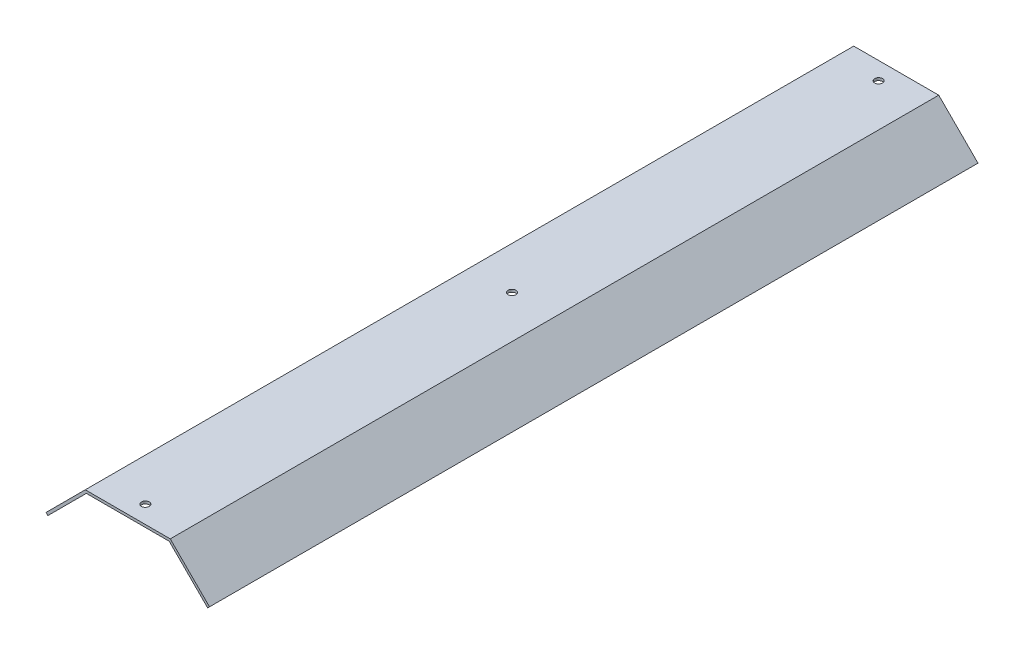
SolidWorks part; units mm, degrees
ref_plane "Plan de face" through (0, 0, 0) normal (0, 0, 1) x (1, 0, 0)
ref_plane "Plan de dessus" through (0, 0, 0) normal (0, 1, 0) x (1, 0, 0)
ref_plane "Plan de droite" through (0, 0, 0) normal (1, 0, 0) x (0, 0, -1)
sketch "Esquisse1" plane through (0, 0, 0) normal (0, 0, 1) x (1, 0, 0)
  line L4 (24.5, 17.5) -> (-24.5, 17.5)
  line L5 (-24.5, 17.5) -> (-47.1274, -5.1274)
  line L6 (-47.1274, -5.1274) -> (-46.0668, -6.1881)
  line L7 (-46.0668, -6.1881) -> (-23.8787, 16)
  line L8 (-23.8787, 16) -> (23.8787, 16)
  line L9 (23.8787, 16) -> (46.0668, -6.1881)
  line L10 (46.0668, -6.1881) -> (47.1274, -5.1274)
  line L11 (47.1274, -5.1274) -> (24.5, 17.5)
  point P5 (0, 16)
  dimension "D1" = 1.5
  dimension "D2" = 49
  dimension "D3" = 1.5
  dimension "D4" = 1.5
  dimension "D5" = 0
  dimension "D6" = 135
  dimension "D7" = 135
  dimension "D8" = 32
  dimension "D9" = 32
  dimension "D10" = 16
extrude "Boss.-Extru.1" add sketch "Esquisse1" along normal blind 443
sketch "Esquisse2" plane through (0, 17.5, 0) normal (0, 1, 0) x (1, 0, 0)
  line L0 (24.5, 0) -> (-24.5, 0) construction
  circle A0 centre (0, -10.15) radius 2.25
  circle A1 centre (0, -221.5) radius 2.25
  circle A2 centre (0, -432.85) radius 2.25
  dimension "D1" = 4.5
  dimension "D3" = 4.5
  dimension "D5" = 4.5
  dimension "D2" = 10.15
  dimension "D4" = 211.35
  dimension "D6" = 211.35
extrude "Enlèv. mat.-Extru.1" cut sketch "Esquisse2" against normal blind 10
